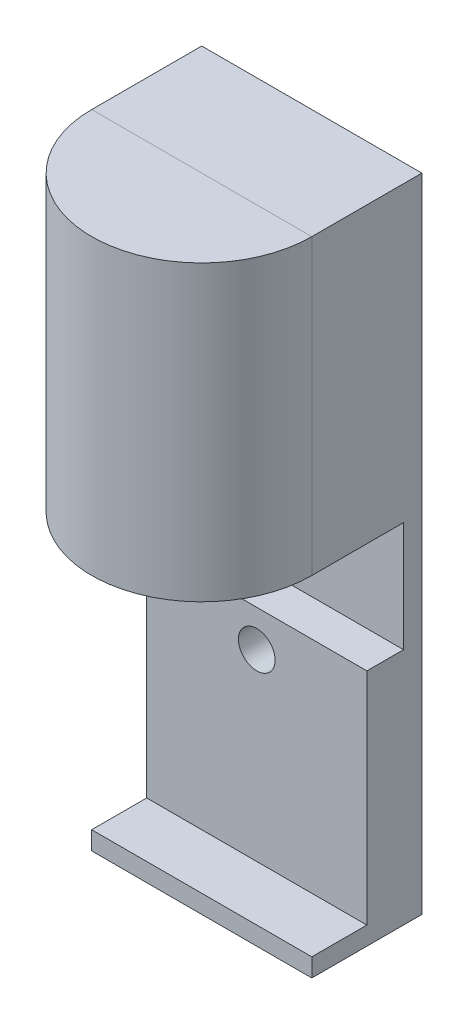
SolidWorks part; units mm, degrees
ref_plane "Front Plane" through (0, 0, 0) normal (0, 0, 1) x (1, 0, 0)
ref_plane "Top Plane" through (0, 0, 0) normal (0, 1, 0) x (1, 0, 0)
ref_plane "Right Plane" through (0, 0, 0) normal (1, 0, 0) x (0, 0, -1)
sketch "Sketch1" plane through (0, 0, 0) normal (0, 0, 1) x (1, 0, 0)
  line L1 (0, 0) -> (60, 0)
  line L2 (0, 0) -> (0, 160)
  line L3 (0, 160) -> (60, 160)
  line L4 (60, 0) -> (60, 160)
  dimension "D1" = 160
  dimension "D2" = 60
revolve "Revolve1" add sketch "Sketch1" angle 180 about L2
sketch "Sketch3" plane through (0, 0, 0) normal (0, 0, 1) x (1, 0, 0)
  line L1 (-60, 160) -> (60, 160)
  line L2 (-60, 160) -> (-60, -190)
  line L3 (-60, -190) -> (60, -190)
  line L4 (60, 160) -> (60, -190)
  dimension "D2" = 120
  dimension "D3" = 350
extrude "Boss-Extrude1" add sketch "Sketch3" against normal blind 60 separate body
sketch "Sketch5" plane through (0, 0, 0) normal (0, 0, 1) x (1, 0, 0)
  line L1 (0, 0) -> (50, 0)
  line L2 (0, 0) -> (0, 150)
  line L3 (0, 150) -> (50, 150)
  line L4 (50, 0) -> (50, 150)
  point P5 (0, 0)
  point P6 (0, 0)
  dimension "D1" = 150
  dimension "D2" = 50
revolve "Cut-Revolve2" cut sketch "Sketch5" angle 360 about L2
sketch "Sketch6" plane through (0, 0, 0) normal (0, 0, 1) x (1, 0, 0)
  line L0 (-60, 0) -> (60, -180) construction
  line L1 (-60, 0) -> (60, 0)
  line L2 (-60, 0) -> (-60, -180)
  line L3 (-60, -180) -> (60, -180)
  line L4 (60, 0) -> (60, -180)
  line L5 (60, 0) -> (-60, -180) construction
  line L6 (0, 0) -> (0, -90) construction
  point P4 (0, -90)
  dimension "D1" = 0
  dimension "D2" = 120
  dimension "D3" = 180
  dimension "D4" = 90
  dimension "D5" = 90
extrude "Cut-Extrude1" cut sketch "Sketch6" against normal blind 50
ref_plane "Plane1" through (0, 0, -30) normal (0, 0, 1) x (1, 0, 0)
sketch "Sketch8" plane through (0, 0, -30) normal (0, 0, 1) x (1, 0, 0)
  line L0 (-60, -60) -> (60, -180) construction
  line L1 (-60, -60) -> (60, -60)
  line L2 (-60, -60) -> (-60, -180)
  line L3 (-60, -180) -> (60, -180)
  line L4 (60, -60) -> (60, -180)
  line L5 (0, 0) -> (0, -120) construction
  line L6 (60, 0) -> (0, 0) construction
  dimension "D1" = 120
  dimension "D2" = 120
  dimension "D3" = 90
  dimension "D4" = 120
extrude "Boss-Extrude2" add sketch "Sketch8" against normal blind 30
sketch "Sketch9" plane through (0, 0, 0) normal (0, 0, 1) x (1, 0, 0)
  line L0 (0, 0) -> (0, -80) construction
  circle A0 centre (0, -80) radius 10
  dimension "D2" = 20
extrude "Cut-Extrude2" cut sketch "Sketch9" against normal blind 70
